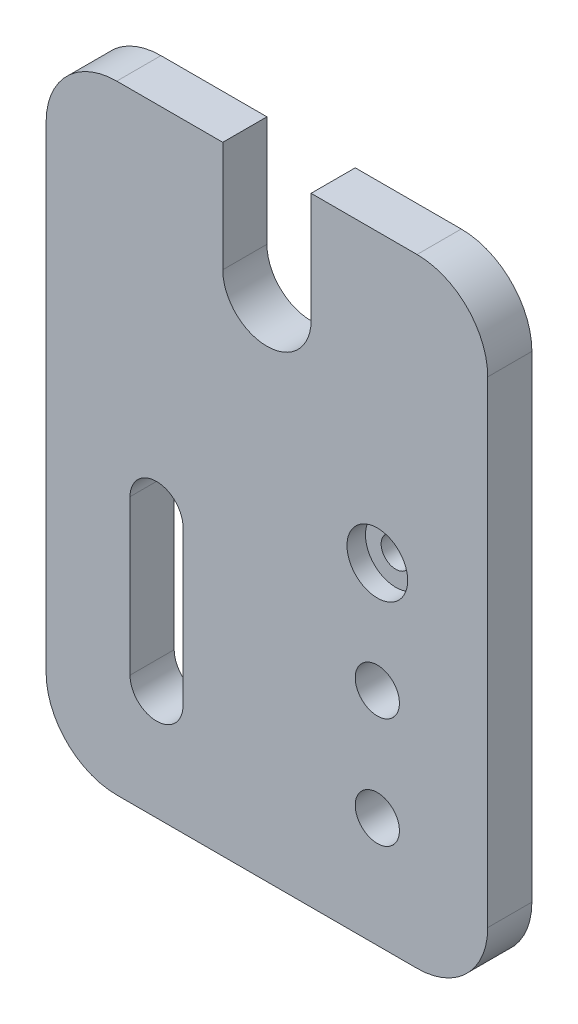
SolidWorks part; units mm, degrees
ref_plane "Front" through (0, 0, 0) normal (0, 0, 1) x (1, 0, 0)
ref_plane "Top" through (0, 0, 0) normal (0, 1, 0) x (1, 0, 0)
ref_plane "Right" through (0, 0, 0) normal (1, 0, 0) x (0, 0, -1)
sketch "Sketch1" plane through (0, 0, 0) normal (0, 0, 1) x (1, 0, 0)
  line L0 (-63.5, 88.9) -> (63.5, -88.9) construction
  line L1 (-63.5, 88.9) -> (63.5, 88.9)
  line L2 (-63.5, 88.9) -> (-63.5, -88.9)
  line L3 (-63.5, -88.9) -> (63.5, -88.9)
  line L4 (63.5, 88.9) -> (63.5, -88.9)
  dimension "D1" = 177.8
  dimension "D2" = 127
extrude "Extrude1" add sketch "Sketch1" along normal mid plane 12.7
fillet "Fillet1" radius 20.32
sketch "Sketch2" plane through (0, 0, 6.35) normal (0, 0, 1) x (1, 0, 0)
  line L0 (-12.7, 88.9) -> (-12.7, 57.15)
  line L2 (43.18, 88.9) -> (-43.18, 88.9) construction
  line L3 (12.7, 57.15) -> (12.7, 88.9)
  line L4 (-12.7, 88.9) -> (12.7, 88.9)
  arc A0 (-12.7, 57.15) -> (12.7, 57.15) centre (0, 57.15) ccw
  dimension "D1" = 12.7
  dimension "D2" = 31.75
extrude "Cut-Extrude1" cut sketch "Sketch2" against normal through all
sketch "Sketch5" plane through (0, 0, 6.35) normal (0, 0, 1) x (1, 0, 0)
  line L0 (-43.18, -88.9) -> (43.18, -88.9) construction
  line L1 (-63.5, 68.58) -> (-63.5, -68.58) construction
  circle A0 centre (31.75, -25.4) radius 6.35
  circle A1 centre (31.75, -57.15) radius 6.35
  dimension "D1" = 12.7
  dimension "D2" = 31.75
  dimension "D3" = 63.5
  dimension "D4" = 95.25
extrude "Cut-Extrude2" cut sketch "Sketch5" against normal through all
hole_wizard "CBORE for 5/16 Binding Head Machine Screw1" positions "Sketch7" profile "Sketch6" counterbore size "5/16" standard "Ansi Inch"
sketch "Sketch7" plane through (0, 0, 6.35) normal (0, 0, 1) x (1, 0, 0)
  point P0 (31.75, 6.35)
  dimension "D1" = 31.75
sketch "Sketch6" plane through (31.75, 6.35, 6.35) normal (1, 0, 0) x (0, -1, 0)
  line L0 (0, 0) -> (0, 27.9335)
  line L1 (0, 27.9335) -> (4.2164, 25.4)
  line L2 (4.2164, 25.4) -> (4.2164, 5.3086)
  line L3 (4.2164, 5.3086) -> (8.7312, 5.3086)
  line L4 (8.7312, 5.3086) -> (8.7312, 0)
  line L5 (8.7312, 0) -> (0, 0)
  line L10 (0, 27.9335) -> (-4.2164, 25.4) construction
  line L11 (0, -6.35) -> (0, 107.95) construction
  dimension "Hole Dia." = 8.4328
  dimension "Hole Depth" = 25.4
  dimension "C'Bore Dia." = 17.4625
  dimension "C'Bore Depth" = 5.3086
  dimension "Drill Angle" = 118
sketch "Sketch8" plane through (0, 0, 6.35) normal (0, 0, 1) x (1, 0, 0)
  line L0 (-39.37, -12.7) -> (-39.37, -57.15)
  line L1 (-24.13, -57.15) -> (-24.13, -12.7)
  line L2 (-43.18, -88.9) -> (43.18, -88.9) construction
  line L3 (-63.5, 68.58) -> (-63.5, -68.58) construction
  arc A0 (-39.37, -57.15) -> (-24.13, -57.15) centre (-31.75, -57.15) ccw
  arc A1 (-24.13, -12.7) -> (-39.37, -12.7) centre (-31.75, -12.7) ccw
  dimension "D3" = 7.62
  dimension "D1" = 31.75
  dimension "D2" = 76.2
  dimension "D4" = 31.75
extrude "Cut-Extrude3" cut sketch "Sketch8" against normal through all
